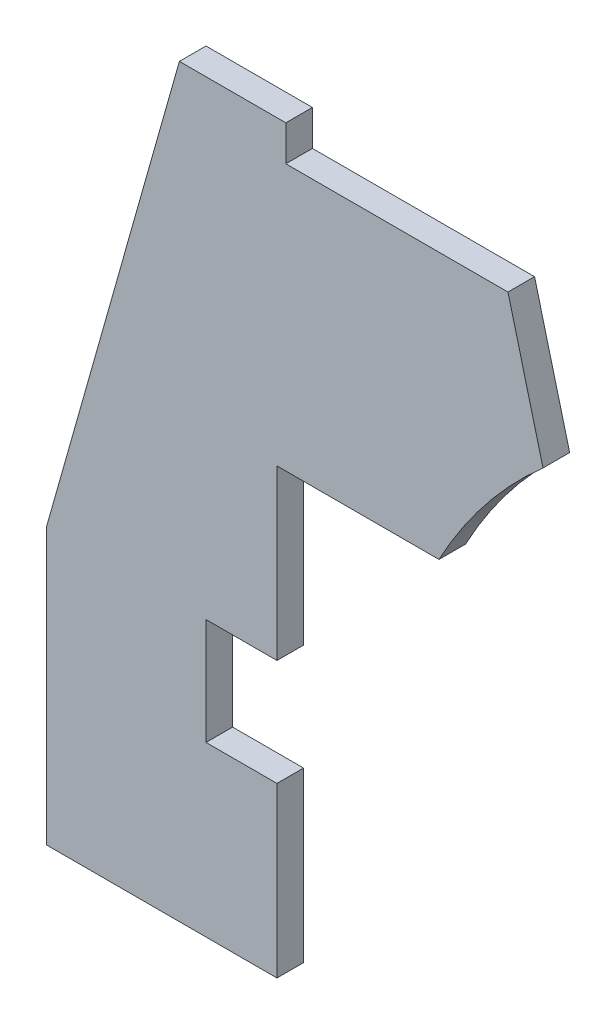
SolidWorks part; units mm, degrees
ref_plane "Plan de face" through (0, 0, 0) normal (0, 0, 1) x (1, 0, 0)
ref_plane "Plan de dessus" through (0, 0, 0) normal (0, 1, 0) x (1, 0, 0)
ref_plane "Plan de droite" through (0, 0, 0) normal (1, 0, 0) x (0, 0, -1)
sketch "Esquisse1" plane through (0, 0, 0) normal (0, 0, 1) x (1, 0, 0)
  line L0 (0, 155) -> (0, 0)
  line L1 (0, 0) -> (130, 0)
  line L2 (130, 0) -> (130, 95)
  line L3 (130, 95) -> (90, 95)
  line L4 (90, 95) -> (90, 155)
  line L5 (90, 155) -> (130, 155)
  line L6 (130, 155) -> (130, 250)
  line L7 (130, 250) -> (221.3336, 250)
  line L8 (0, 155) -> (75, 420)
  line L9 (75, 420) -> (135, 420)
  line L10 (135, 420) -> (135, 400)
  line L11 (135, 400) -> (260.2082, 400)
  line L12 (260.2082, 400) -> (280, 323.9975)
  line L13 (280, 323.9975) -> (255, 420) construction
  line L14 (255, 420) -> (135, 420) construction
  arc A0 (221.3336, 250) -> (280, 323.9975) centre (455, 125) cw
  dimension "D12" = 265
  dimension "D2" = 130
  dimension "D3" = 95
  dimension "D4" = 60
  dimension "D5" = 40
  dimension "D6" = 40
  dimension "D7" = 250
  dimension "D8" = 420
  dimension "D9" = 75
  dimension "D10" = 325
  dimension "D11" = 125
  dimension "D13" = 20
  dimension "D14" = 175
  dimension "D15" = 200
  dimension "D16" = 120
  dimension "D17" = 265
extrude "Extrusion1" add sketch "Esquisse1" along normal blind 15
